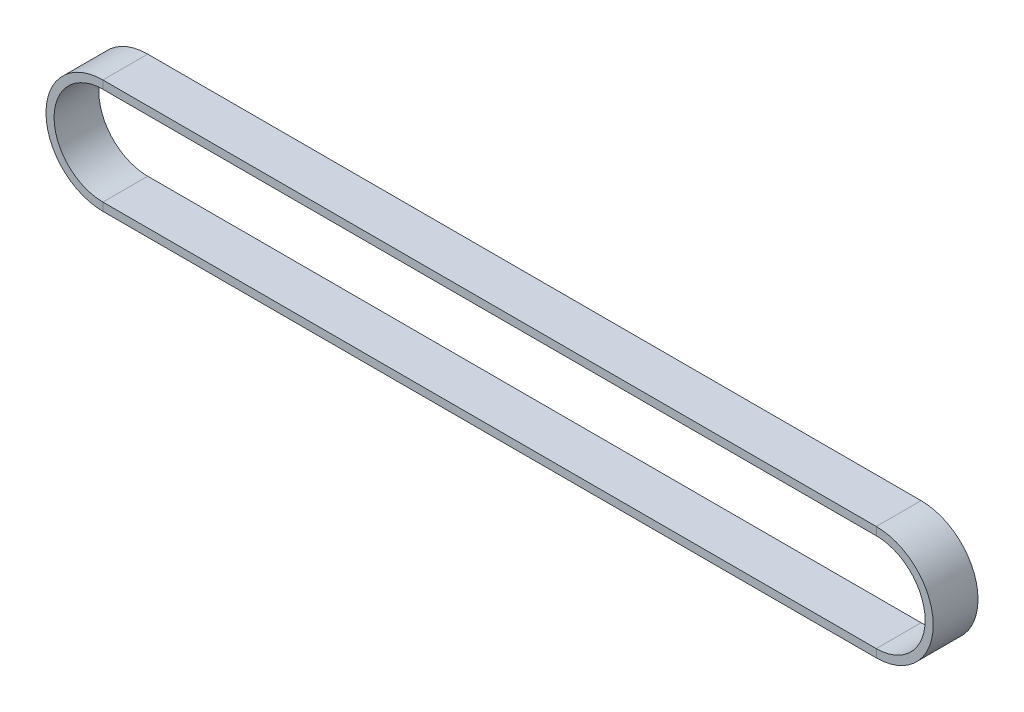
SolidWorks part; units mm, degrees
ref_plane "Front Plane" through (0, 0, 0) normal (0, 0, 1) x (1, 0, 0)
ref_plane "Top Plane" through (0, 0, 0) normal (0, 1, 0) x (1, 0, 0)
ref_plane "Right Plane" through (0, 0, 0) normal (1, 0, 0) x (0, 0, -1)
sketch "Sketch2" plane through (0, 0, 0) normal (0, 0, 1) x (1, 0, 0)
  line L0 (0, 0) -> (1, 0) construction
  line L1 (0, 0) -> (0, 1) construction
  line L2 (0, -29.5) -> (-431.5, -29.5)
  line L3 (-431.5, 29.5) -> (0, 29.5)
  arc A0 (0, 29.5) -> (0, -29.5) centre (0, 0) cw
  arc A1 (-431.5, -29.5) -> (-431.5, 29.5) centre (-431.5, 0) cw
ref_plane "Plane1" through (0, 29.5, 0) normal (1, 0, 0) x (0, 0, -1)
sketch "Sketch3" plane through (0, 29.5, 0) normal (1, 0, 0) x (0, 0, -1)
  line L0 (0, 0) -> (0, -59) construction
  line L1 (-12.5, 2.25) -> (12.5, 2.25)
  line L2 (-12.5, 2.25) -> (-12.5, -2.25)
  line L3 (-12.5, -2.25) -> (12.5, -2.25)
  line L4 (12.5, 2.25) -> (12.5, -2.25)
  line L5 (-12.5, 2.25) -> (12.5, -2.25) construction
  line L6 (-12.5, -2.25) -> (12.5, 2.25) construction
  point P0 (0, 0)
  dimension "D1" = 4.5
  dimension "D2" = 25
sweep "Sweep1" add profiles "Sketch3" path "Sketch2"
